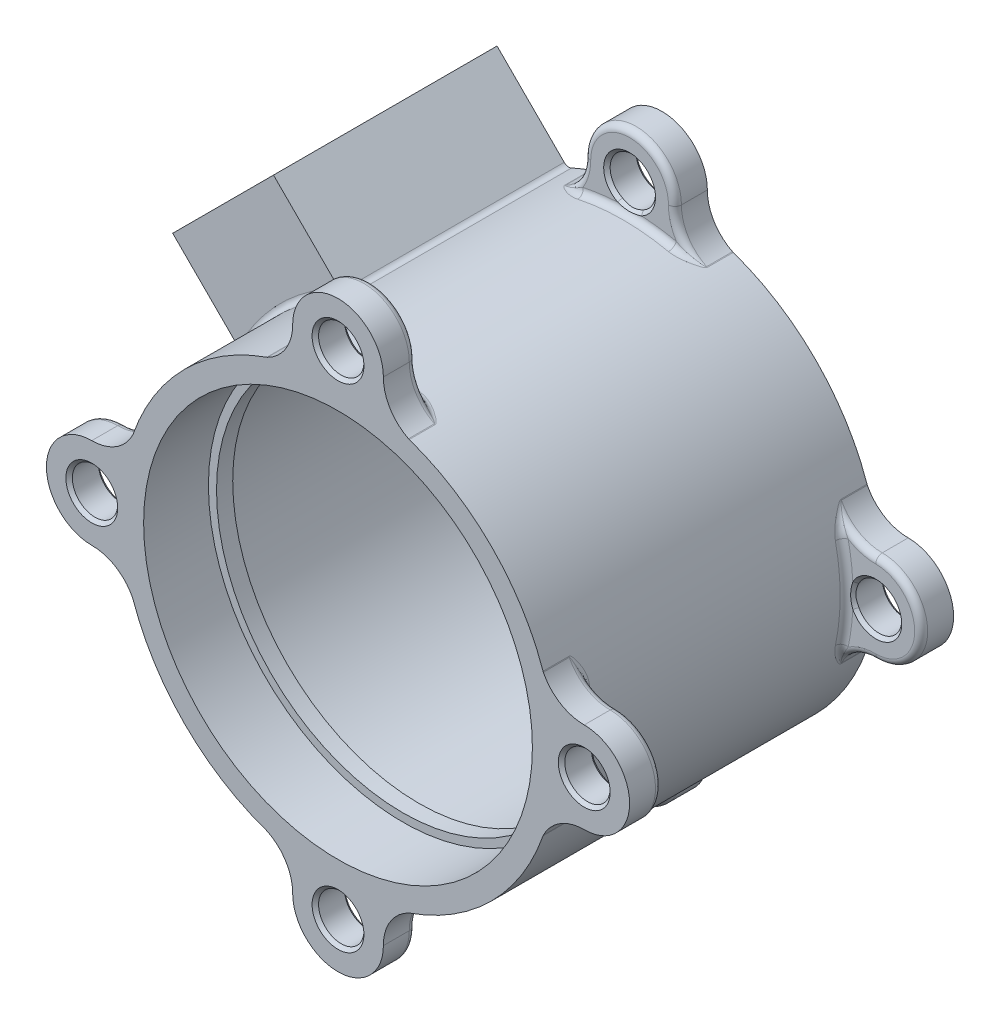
SolidWorks part; units mm, degrees
ref_plane "Přední rovina" through (0, 0, 0) normal (0, 0, 1) x (1, 0, 0)
ref_plane "Horní rovina" through (0, 0, 0) normal (0, 1, 0) x (1, 0, 0)
ref_plane "Pravá rovina" through (0, 0, 0) normal (1, 0, 0) x (0, 0, -1)
sketch "Skica2" plane through (0, 0, 0) normal (0, 0, 1) x (1, 0, 0)
  line L0 (0, 0) -> (67, 0) construction
  line L1 (0, 0) -> (0, 67) construction
  circle A0 centre (0, 0) radius 67
  circle A1 centre (0, 0) radius 60
  dimension "D1" = 134
  dimension "D2" = 120
extrude "Přidat vysunutím1" add sketch "Skica2" along normal blind 100
sketch "Skica5" plane through (0, 0, 100) normal (0, 0, 1) x (1, 0, 0)
  line L0 (0, 0) -> (60, 0) construction
  line L1 (0, 0) -> (0, 60) construction
  circle A0 centre (0, 0) radius 60
  circle A1 centre (0, 0) radius 57.5
  dimension "D1" = 115
extrude "Přidat vysunutím3" add sketch "Skica5" against normal blind 25
sketch "Skica9" plane through (0, 0, 100) normal (0, 0, 1) x (1, 0, 0)
  line L0 (0, 0) -> (60, 0) construction
  line L1 (0, 0) -> (0, 60) construction
  circle A1 centre (0, 0) radius 57.5
  circle A2 centre (0, 0) radius 60
  dimension "D1" = 120
  dimension "D2" = 115
extrude "Odebrat vysunutím3" cut sketch "Skica9" against normal blind 20
sketch "Skica6" plane through (0, 0, 100) normal (0, 0, 1) x (1, 0, 0)
  line L0 (0, 0) -> (0, 67) construction
  line L1 (0, 0) -> (67, 0) construction
  line L2 (0, 76) -> (0, 67) construction
  arc A0 (24.479, 62.3681) -> (14, 76) centre (27.9998, 75.9182) cw
  circle A38 centre (0, 0) radius 67 construction
  arc A41 (24.479, 62.3681) -> (-24.479, 62.3681) centre (0, 0) ccw
  arc A48 (-24.479, 62.3681) -> (-14, 76) centre (-27.9998, 75.9182) ccw
  arc A49 (13.9998, 75.9182) -> (-13.9998, 75.9182) centre (0, 76) ccw
  arc A50 (62.3681, -24.479) -> (62.3681, 24.479) centre (0, 0) ccw
  arc A51 (62.3681, 24.479) -> (76, 14) centre (75.9182, 27.9998) ccw
  arc A52 (75.9182, -13.9998) -> (75.9182, 13.9998) centre (76, 0) ccw
  arc A53 (62.3681, -24.479) -> (76, -14) centre (75.9182, -27.9998) cw
  arc A54 (-24.479, -62.3681) -> (24.479, -62.3681) centre (0, 0) ccw
  arc A55 (24.479, -62.3681) -> (14, -76) centre (27.9998, -75.9182) ccw
  arc A56 (-13.9998, -75.9182) -> (13.9998, -75.9182) centre (0, -76) ccw
  arc A57 (-24.479, -62.3681) -> (-14, -76) centre (-27.9998, -75.9182) cw
  arc A58 (-62.3681, 24.479) -> (-62.3681, -24.479) centre (0, 0) ccw
  arc A59 (-62.3681, -24.479) -> (-76, -14) centre (-75.9182, -27.9998) ccw
  arc A60 (-75.9182, 13.9998) -> (-75.9182, -13.9998) centre (-76, 0) ccw
  arc A61 (-62.3681, 24.479) -> (-76, 14) centre (-75.9182, 27.9998) cw
  point P44 (0, 0)
  dimension "D1" = 9
  dimension "D2" = 14
  dimension "D3" = 14
extrude "Přidat vysunutím4" add sketch "Skica6" against normal blind 10
sketch "Skica12" plane through (0, 0, 0) normal (0, 0, -1) x (-1, 0, 0)
  line L0 (0, 0) -> (67, 0) construction
  line L1 (0, 0) -> (0, 67) construction
  line L3 (0, 67) -> (0, 76) construction
  arc A0 (24.479, 62.3681) -> (-24.479, 62.3681) centre (0, 0) ccw
  arc A1 (13.9998, 75.9182) -> (-13.9998, 75.9182) centre (0, 76) ccw
  arc A22 (24.479, 62.3681) -> (14, 76) centre (27.9998, 75.9182) cw
  arc A23 (-24.479, 62.3681) -> (-14, 76) centre (-27.9998, 75.9182) ccw
  arc A24 (75.9182, -13.9998) -> (75.9182, 13.9998) centre (76, 0) ccw
  arc A25 (62.3681, 24.479) -> (76, 14) centre (75.9182, 27.9998) ccw
  arc A26 (62.3681, -24.479) -> (62.3681, 24.479) centre (0, 0) ccw
  arc A27 (62.3681, -24.479) -> (76, -14) centre (75.9182, -27.9998) cw
  arc A28 (-13.9998, -75.9182) -> (13.9998, -75.9182) centre (0, -76) ccw
  arc A29 (24.479, -62.3681) -> (14, -76) centre (27.9998, -75.9182) ccw
  arc A30 (-24.479, -62.3681) -> (24.479, -62.3681) centre (0, 0) ccw
  arc A31 (-24.479, -62.3681) -> (-14, -76) centre (-27.9998, -75.9182) cw
  arc A32 (-75.9182, 13.9998) -> (-75.9182, -13.9998) centre (-76, 0) ccw
  arc A33 (-62.3681, -24.479) -> (-76, -14) centre (-75.9182, -27.9998) ccw
  arc A34 (-62.3681, 24.479) -> (-62.3681, -24.479) centre (0, 0) ccw
  arc A35 (-62.3681, 24.479) -> (-76, 14) centre (-75.9182, 27.9998) cw
  point P42 (0, 0)
  dimension "D1" = 9
  dimension "D2" = 14
  dimension "D3" = 134
  dimension "D4" = 14
extrude "Přidat vysunutím6" add sketch "Skica12" against normal blind 10 contours A23 A0 A22 A1 | A34 A35 A32 A33 | A31 A28 A29 A30 | A26 A27 A24 A25
sketch "Skica23" plane through (0, 0, 0) normal (0, 0, -1) x (-1, 0, 0)
  line L0 (31.8198, 62.9325) -> (62.9325, 31.8198)
  line L1 (47.3762, 47.3762) -> (0, 0) construction
  line L2 (0, 0) -> (67, 0) construction
  line L6 (62.9325, 31.8198) -> (60.3057, 29.193)
  line L8 (31.8198, 62.9325) -> (29.193, 60.3057)
  arc A1 (60.3057, 29.193) -> (29.193, 60.3057) centre (0, 0) ccw
  dimension "D1" = 67
  dimension "D2" = 45
  dimension "D3" = 44
extrude "Přidat vysunutím9" add sketch "Skica23" against normal blind 69
sketch "Skica27" plane through (-47.3762, 47.3762, 0) normal (-0.7071, 0.7071, 0) x (0, 0, 1)
  line L1 (69, 22) -> (0, 22)
  line L2 (0, 22) -> (0, -22)
  line L3 (0, -22) -> (69, -22)
  line L4 (69, -22) -> (69, 22)
  line L7 (64, 17) -> (64, -17)
  line L8 (64, -17) -> (5, -17)
  line L9 (5, -17) -> (5, 17)
  line L10 (5, 17) -> (64, 17)
  dimension "D1" = 34
  dimension "D2" = 59
  dimension "D3" = 5
  dimension "D4" = 5
extrude "Přidat vysunutím10" add sketch "Skica27" along normal blind 27
sketch "Skica28" plane through (-47.3762, 47.3762, 0) normal (-0.7071, 0.7071, 0) x (0, 0, 1)
  line L0 (5, 0) -> (64, 0) construction
  line L1 (5, 17) -> (5, -17) construction
  line L2 (64, -17) -> (64, 17) construction
  line L4 (64, 17) -> (5, 17) construction
  line L5 (34.5, 17) -> (34.5, -17) construction
  line L6 (5, -17) -> (64, -17) construction
  circle A0 centre (51, 0) radius 2.5
  circle A1 centre (33, 0) radius 2.5
  dimension "D3" = 5
  dimension "D4" = 5
  dimension "D1" = 13
  dimension "D2" = 18
extrude "Odebrat vysunutím12" cut sketch "Skica28" against normal blind 5
sketch "Skica29" plane through (-47.3762, 47.3762, 0) normal (-0.7071, 0.7071, 0) x (0, 0, 1)
  line L0 (0, 0) -> (15, 0) construction
  circle A0 centre (15, 0) radius 5
  dimension "D2" = 10
  dimension "D1" = 15
extrude "Odebrat vysunutím13" cut sketch "Skica29" against normal up to surface (7.2087 mm away)
sketch "Skica30" plane through (-66.468, 66.468, 0) normal (-0.7071, 0.7071, 0) x (0, 0, 1)
  line L0 (0, 0) -> (69, 0) construction
  line L1 (69, -22) -> (69, 22) construction
  line L3 (69, 22) -> (0, 22) construction
  line L4 (34.5, 22) -> (34.5, -22) construction
  line L5 (69, -22) -> (0, -22) construction
  circle A0 centre (3.5, 18.5) radius 1.5
  circle A1 centre (3.5, -18.5) radius 1.5
  circle A2 centre (65.5, -18.5) radius 1.5
  circle A3 centre (65.5, 18.5) radius 1.5
  dimension "D1" = 3
  dimension "D2" = 31
  dimension "D3" = 18.5
extrude "Odebrat vysunutím14" cut sketch "Skica30" against normal blind 5
fillet "Zaoblit1" radius 2 59 edges at (67, 0, 90) (0, 67, 90) (-35.3553, 59.397, 34.5) (-47.3762, 47.3762, 64) (-47.3762, 47.3762, 5) (-59.397, 35.3553, 34.5) (-60.3057, 29.193, 34.5) (-29.193, 60.3057, 34.5) (-47.3762, 47.3762, 69) (-21.8792, 63.3269, 95) (21.8792, 63.3269, 95) (63.3269, -21.8792, 95) (63.3269, 21.8792, 95) (63.3269, 21.8792, 5) (63.3269, -21.8792, 5) (-21.8792, -63.3269, 5) (21.8792, -63.3269, 5) (21.8792, -63.3269, 95) (-21.8792, -63.3269, 95) (-63.3269, 21.8792, 95) (-63.3269, -21.8792, 95) (-63.3269, -21.8792, 5) (-63.3269, 21.8792, 5) (-21.8792, 63.3269, 5) (21.8792, 63.3269, 5) (0, 90, 90) (-16.1103, 68.5262, 90) (16.1103, 68.5262, 90) (68.5262, -16.1103, 90) (90, 0, 90) (68.5262, 16.1103, 90) (68.5262, 16.1103, 10) (90, 0, 10) (68.5262, -16.1103, 10) (67, 0, 10) (0, -90, 10) (-16.1103, -68.5262, 10) (0, -67, 10) (16.1103, -68.5262, 10) (0, -90, 90) (16.1103, -68.5262, 90) (0, -67, 90) (-16.1103, -68.5262, 90) (-68.5262, 16.1103, 90) (-90, 0, 90) (-68.5262, -16.1103, 90) (-67, 0, 90) (-68.5262, -16.1103, 10) (-90, 0, 10) (-68.5262, 16.1103, 10) (-67, 0, 10) (0, 67, 10) (-16.1103, 68.5262, 10) (0, 90, 10) (16.1103, 68.5262, 10) (-68.9429, 44.9013, 64) (-44.9013, 68.9429, 64) (-68.9429, 44.9013, 5) (-44.9013, 68.9429, 5)
sketch "Skica13" plane through (0, 0, 0) normal (0, 0, -1) x (-1, 0, 0)
  line L0 (0, 0) -> (0, 67) construction
  line L1 (0, 67) -> (0, 76) construction
  circle A1 centre (0, 76) radius 7
  circle A5 centre (76, 0) radius 7
  circle A6 centre (0, -76) radius 7
  circle A7 centre (-76, 0) radius 7
  point P14 (0, 0)
  point P15 (0, 0)
  dimension "D1" = 9
  dimension "D3" = 14
  dimension "D2" = 67
extrude "Odebrat vysunutím5" cut sketch "Skica13" against normal blind 10
sketch "Skica7" plane through (0, 0, 100) normal (0, 0, 1) x (1, 0, 0)
  line L0 (0, 0) -> (67, 0) construction
  line L1 (0, 76) -> (0, 67) construction
  line L2 (0, 67) -> (0, 0) construction
  circle A9 centre (0, 76) radius 7
  circle A10 centre (76, 0) radius 7
  circle A11 centre (0, -76) radius 7
  circle A12 centre (-76, 0) radius 7
  point P16 (0, 0)
  point P17 (0, 0)
  dimension "D1" = 67
  dimension "D2" = 9
  dimension "14" = 14
extrude "Odebrat vysunutím2" cut sketch "Skica7" against normal blind 10
chamfer "Zkosení1" distance 1 angle 45 26 edges at (-78.4889, 54.4472, 34.5) (-66.468, 66.468, 64) (-54.4472, 78.4889, 34.5) (-66.468, 66.468, 5) (-38.8424, 45.7304, 13.8695) (-50.9117, 43.8406, 15) (7, 76, 90) (7, 76, 100) (83, 0, 90) (83, 0, 100) (-83, 0, 10) (-83, 0, 0) (-69, 0, 90) (-69, 0, 100) (7, -76, 90) (7, -76, 100) (-7, -76, 10) (-7, -76, 0) (-7, 76, 10) (-7, 76, 0) (69, 0, 10) (69, 0, 0) (-78.0746, 54.8614, 63.4142) (-78.0746, 54.8614, 5.5858) (-54.8614, 78.0746, 63.4142) (-54.8614, 78.0746, 5.5858)
